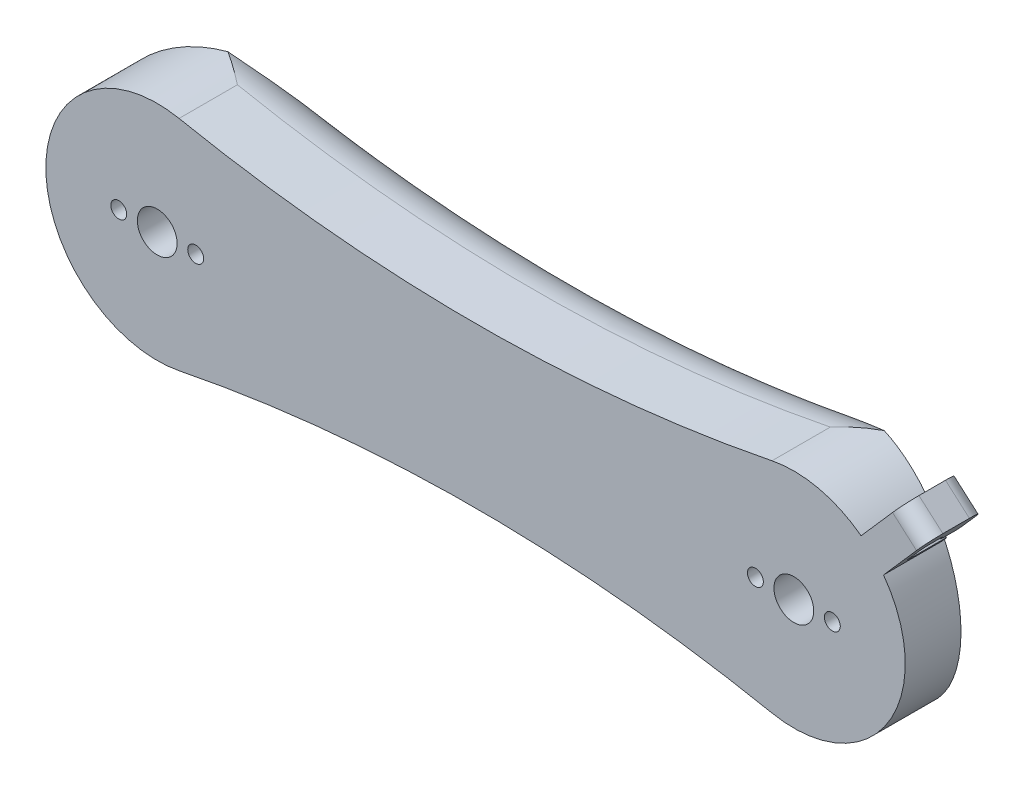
SolidWorks part; units mm, degrees
ref_plane "Front Plane" through (0, 0, 0) normal (0, 0, 1) x (1, 0, 0)
ref_plane "Top Plane" through (0, 0, 0) normal (0, 1, 0) x (1, 0, 0)
ref_plane "Right Plane" through (0, 0, 0) normal (1, 0, 0) x (0, 0, -1)
sketch "Sketch1" plane through (0, 0, 0) normal (0, 0, 1) x (1, 0, 0)
  line L0 (-793.7478, 0) -> (38893.641, 0) construction
  line L1 (0, -793.7478) -> (0, 38893.641) construction
  arc A0 (-55.8816, 20.5922) -> (-55.8816, -20.5922) centre (-60, 0) ccw
  arc A1 (55.8816, -20.5922) -> (55.8816, 20.5922) centre (60, 0) ccw
  arc A2 (-55.8816, 20.5922) -> (55.8816, 20.5922) centre (0, 300) ccw
  arc A3 (-55.8816, -20.5922) -> (55.8816, -20.5922) centre (0, -300) cw
  circle A4 centre (60, 0) radius 3.75
  circle A5 centre (67.25, 0) radius 1.5
  circle A6 centre (52.75, 0) radius 1.5
  circle A7 centre (-67.25, 0) radius 1.5
  circle A8 centre (-60, 0) radius 3.75
  circle A9 centre (-52.75, 0) radius 1.5
  dimension "D1" = 42
  dimension "D2" = 42
  dimension "D4" = 305.9412
  dimension "D5" = 300
  dimension "D6" = 7.5
  dimension "D7" = 3
  dimension "D9" = 3
  dimension "D3" = 120
  dimension "D8" = 7.25
  dimension "D10" = 7.25
extrude "Boss-Extrude1" add sketch "Sketch1" along normal blind 21
sketch "Sketch3" plane through (0, 0, 0) normal (0, 0, -1) x (-1, 0, 0)
  circle A0 centre (-60, 0) radius 18
  circle A1 centre (60, 0) radius 18
  dimension "D1" = 36
  dimension "D2" = 36
extrude "Cut-Extrude2" cut sketch "Sketch3" against normal blind 15
sketch "Sketch4" plane through (0, 0, 0) normal (1, 0, 0) x (0, 0, -1)
  line L0 (0, -18) -> (0, 18) construction
  circle A0 centre (-9, 0) radius 5
  point P2 (0, 0)
  dimension "D1" = 10
  dimension "D2" = 9
extrude "Cut-Extrude3" cut sketch "Sketch4" against normal mid plane 98
sketch "Sketch5" plane through (0, 0, 0) normal (0, 1, 0) x (1, 0, 0)
  line L0 (-38.0194, 0) -> (-81, -10.5)
  line L1 (-81, 0) -> (-81, -21) construction
  line L2 (-81, -10.5) -> (-81, 12.0594)
  line L3 (-81, 12.0594) -> (-38.0194, 12.0594)
  line L4 (-38.0194, 12.0594) -> (-38.0194, 0)
  line L5 (0, -11.55) -> (0, 11.55) construction
  line L6 (81, -10.5) -> (81, 12.0594)
  line L7 (38.0194, 12.0594) -> (38.0194, 0)
  line L8 (38.0194, 0) -> (81, -10.5)
  line L9 (81, 12.0594) -> (38.0194, 12.0594)
extrude "Cut-Extrude5" cut sketch "Sketch5" against normal mid plane 98
fillet "Fillet2" radius 10 2 edges at (0, 15.0588, 0) (0, -15.0588, 0)
sketch "Sketch7" plane through (0, 0, 21) normal (0, 0, 1) x (1, 0, 0)
  line L0 (72.675, 16.7435) -> (80.5861, 25.7665)
  line L1 (80.5861, 25.7665) -> (85.0976, 21.8109)
  line L2 (85.0976, 21.8109) -> (76.9017, 12.4632)
  arc A0 (55.8816, -20.5922) -> (55.8816, 20.5922) centre (60, 0) ccw construction
  arc A1 (76.9017, 12.4632) -> (72.675, 16.7435) centre (60, 0) ccw
  point P8 (74.9424, 14.7555)
  dimension "D1" = 12
  dimension "D2" = 6
  dimension "D3" = 12
extrude "Boss-Extrude2" add sketch "Sketch7" against normal blind 11
fillet "Fillet3" radius 3 1 edges at (82.8418, 23.7887, 21)
fillet "Fillet4" radius 3 1 edges at (82.8418, 23.7887, 10)
sketch "Sketch8" plane through (37.3005, -32.704, 0) normal (0.7519, -0.6593, 0) x (0, 0, -1)
  line L0 (-18, 62.0694) -> (-18, 66.0694)
  line L1 (-17, 67.0694) -> (-15, 67.0694)
  line L3 (-10, 60.0694) -> (-10, 69.5013) construction
  line L4 (-10, 66.0694) -> (-10, 62.0694)
  line L5 (-10, 62.0694) -> (-18, 62.0694)
  line L6 (-10, 60.0694) -> (-21, 60.0694) construction
  line L8 (-13, 65.0694) -> (-11, 65.0694)
  arc A0 (-18, 66.0694) -> (-17, 67.0694) centre (-17, 66.0694) cw
  arc A1 (-15, 67.0694) -> (-14, 66.0694) centre (-15, 66.0694) cw
  arc A2 (-10, 66.0694) -> (-11, 65.0694) centre (-11, 66.0694) cw
  arc A3 (-14, 66.0694) -> (-13, 65.0694) centre (-13, 66.0694) ccw
  dimension "D3" = 1
  dimension "D4" = 1
  dimension "D6" = 1
  dimension "D7" = 2
  dimension "D8" = 1
  dimension "D1" = 2
  dimension "D2" = 4
  dimension "D5" = 2
  dimension "D9" = 4
extrude "Cut-Extrude6" cut sketch "Sketch8" against normal blind 11
fillet "Fillet5" radius 1 1 edges at (75.9645, 15.9448, 10)
